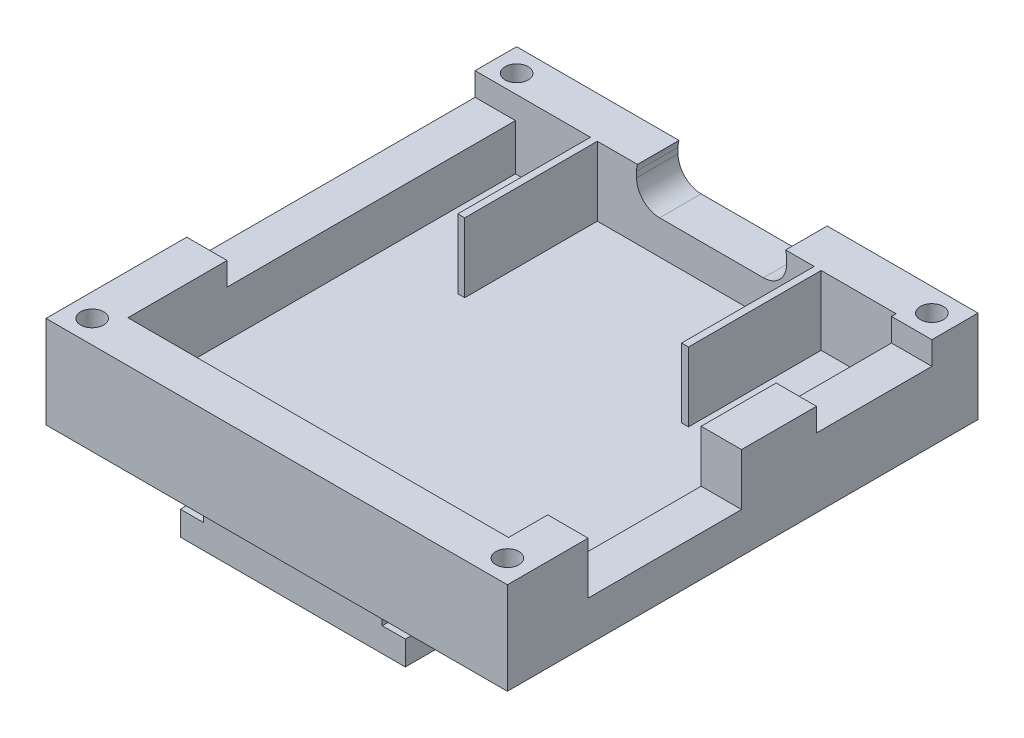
SolidWorks part; units mm, degrees
ref_plane "Alzado" through (0, 0, 0) normal (0, 0, 1) x (1, 0, 0)
ref_plane "Planta" through (0, 0, 0) normal (0, 1, 0) x (1, 0, 0)
ref_plane "Vista lateral" through (0, 0, 0) normal (1, 0, 0) x (0, 0, -1)
sketch "Sketch1" plane through (0, 0, 0) normal (0, 0, 1) x (1, 0, 0)
  line L0 (7.75, 2.1) -> (9.75, 2.1)
  line L1 (-9.75, 2.1) -> (-7.75, 2.1)
  line L2 (-9.75, 2.1) -> (-9.75, 0)
  line L3 (-9.75, 0) -> (9.75, 0)
  line L4 (9.75, 2.1) -> (9.75, 0)
  line L5 (-9.75, 2.1) -> (9.75, 0) construction
  line L6 (-9.75, 0) -> (9.75, 2.1) construction
  line L8 (-7.75, 4) -> (-7.75, 2.1)
  line L10 (7.75, 4) -> (7.75, 2.1)
  line L11 (-7.75, 4) -> (7.75, 2.1) construction
  line L12 (-7.75, 2.1) -> (7.75, 4) construction
  line L13 (7.75, 4) -> (20, 4)
  line L14 (-20, 12) -> (20, 12)
  line L15 (-20, 12) -> (-20, 4)
  line L16 (-20, 4) -> (-7.75, 4)
  line L17 (20, 12) -> (20, 4)
  line L18 (-20, 12) -> (20, 4) construction
  line L19 (-20, 4) -> (20, 12) construction
  point P0 (0, 1.05)
  point P7 (0, 3.05)
  point P12 (0, 8)
extrude "Boss-Extrude1" add sketch "Sketch1" along normal blind 38
sketch "Sketch2" plane through (0, 0, 38) normal (0, 0, 1) x (1, 0, 0)
  line L1 (-20, 4) -> (20, 4)
  line L2 (-20, 4) -> (-20, 12)
  line L3 (-20, 12) -> (20, 12)
  line L4 (20, 4) -> (20, 12)
  line L5 (-20, 4) -> (20, 12) construction
  line L6 (-20, 12) -> (20, 4) construction
  point P0 (0, 8)
extrude "Boss-Extrude2" add sketch "Sketch2" along normal blind 1.4
sketch "Sketch3" plane through (0, 0, 0) normal (0, 0, -1) x (-1, 0, 0)
  line L0 (20, 4) -> (7.75, 4) construction
  line L1 (-20, 4) -> (20, 4)
  line L2 (-20, 4) -> (-20, 12)
  line L3 (-20, 12) -> (20, 12)
  line L4 (20, 4) -> (20, 12)
  line L5 (-20, 4) -> (20, 12) construction
  line L6 (-20, 12) -> (20, 4) construction
  point P0 (0, 8)
extrude "Boss-Extrude3" add sketch "Sketch3" along normal blind 1.4
sketch "Sketch4" plane through (0, 12, 0) normal (0, 1, 0) x (1, 0, 0)
  line L0 (20, -39.4) -> (20, 1.4) construction
  line L1 (-16.5, -35.8) -> (16.5, -35.8)
  line L2 (-16.5, -35.8) -> (-16.5, -2.2)
  line L3 (-16.5, -2.2) -> (16.5, -2.2)
  line L4 (16.5, -35.8) -> (16.5, -2.2)
  line L5 (-16.5, -35.8) -> (16.5, -2.2) construction
  line L6 (-16.5, -2.2) -> (16.5, -35.8) construction
  point P0 (0, -19)
  point P11 (20, -19)
extrude "Cut-Extrude1" cut sketch "Sketch4" against normal blind 6
sketch "Sketch7" plane through (-20, 0, 0) normal (-1, 0, 0) x (0, 0, 1)
  line L0 (39.4, 12) -> (-1.4, 12) construction
  line L1 (2.2, 10) -> (27.2, 10)
  line L2 (2.2, 10) -> (2.2, 14)
  line L3 (2.2, 14) -> (27.2, 14)
  line L4 (27.2, 10) -> (27.2, 14)
  line L5 (2.2, 10) -> (27.2, 14) construction
  line L6 (2.2, 14) -> (27.2, 10) construction
  line L7 (-1.4, 4) -> (-1.4, 12) construction
  point P0 (14.7, 12)
  dimension "D1" = 4
  dimension "D2" = 25
  dimension "D3" = 3.6
extrude "Cut-Extrude3" cut sketch "Sketch7" against normal blind 12
sketch "Sketch8" plane through (0, 6, 0) normal (0, 1, 0) x (1, 0, 0)
  line L5 (16.5, -2.2) -> (-20, -2.2) construction
  line L6 (-10, -13.7) -> (-9.4, -13.7)
  line L13 (-10, -13.7) -> (-10, -2.2)
  line L16 (-10, -2.2) -> (-9.4, -2.2)
  line L17 (10, -13.7) -> (10, -2.2)
  line L18 (-10, -13.7) -> (10, -2.2) construction
  line L19 (-10, -2.2) -> (10, -13.7) construction
  line L20 (9.4, -13.7) -> (10, -13.7)
  line L22 (-9.4, -13.7) -> (-9.4, -2.2)
  line L24 (9.4, -13.7) -> (9.4, -2.2)
  line L25 (-9.4, -13.7) -> (9.4, -2.2) construction
  line L26 (-9.4, -2.2) -> (9.4, -13.7) construction
  line L27 (9.4, -2.2) -> (10, -2.2)
  point P0 (0, -7.95)
  point P7 (0, -7.95)
  dimension "D1" = 20
  dimension "D2" = 11.5
  dimension "D3" = 0.6
sketch "Sketch9" plane through (20, 0, 0) normal (1, 0, 0) x (0, 0, -1)
  line L0 (-39.4, 12) -> (1.4, 12) construction
  line L1 (-12.6, 14) -> (-2.6, 14)
  line L2 (-12.6, 14) -> (-12.6, 10)
  line L3 (-12.6, 10) -> (-2.6, 10)
  line L4 (-2.6, 14) -> (-2.6, 10)
  line L5 (-12.6, 14) -> (-2.6, 10) construction
  line L6 (-12.6, 10) -> (-2.6, 14) construction
  line L7 (1.4, 12) -> (1.4, 4) construction
  line L9 (-32.4, 7.5) -> (-19.1, 7.5)
  line L10 (-32.4, 7.5) -> (-32.4, 16.5)
  line L11 (-32.4, 16.5) -> (-19.1, 16.5)
  line L12 (-19.1, 7.5) -> (-19.1, 16.5)
  line L13 (-32.4, 7.5) -> (-19.1, 16.5) construction
  line L14 (-32.4, 16.5) -> (-19.1, 7.5) construction
  point P0 (-7.6, 12)
  point P9 (-25.75, 12)
  dimension "D1" = 4
  dimension "D2" = 10
  dimension "D3" = 4
  dimension "D4" = 9
  dimension "D5" = 13.3
  dimension "D6" = 6.5
extrude "Cut-Extrude4" cut sketch "Sketch9" against normal blind 7
sketch "Sketch10" plane through (0, 0, -1.4) normal (0, 0, -1) x (-1, 0, 0)
  line L0 (20, 12) -> (-20, 12) construction
  line L1 (-5, 13.45) -> (4, 13.45)
  line L2 (-7, 11.45) -> (-7, 10.95)
  line L3 (-5, 8.95) -> (4, 8.95)
  line L4 (6, 11.45) -> (6, 10.95)
  line L5 (-7, 13.45) -> (6, 8.95) construction
  line L6 (-7, 8.95) -> (6, 13.45) construction
  line L7 (20, 4) -> (20, 12) construction
  arc A0 (-7, 10.95) -> (-5, 8.95) centre (-5, 10.95) ccw
  arc A1 (6, 10.95) -> (4, 8.95) centre (4, 10.95) cw
  arc A2 (6, 11.45) -> (4, 13.45) centre (4, 11.45) ccw
  arc A3 (-5, 13.45) -> (-7, 11.45) centre (-5, 11.45) ccw
  point P0 (-0.5, 11.2)
  dimension "D5" = 2
  dimension "D1" = 4.5
  dimension "D2" = 13
  dimension "D3" = 0.8
  dimension "D4" = 14
extrude "Cut-Extrude5" cut sketch "Sketch10" against normal blind 7
sketch "Sketch11" plane through (0, 12, 0) normal (0, 1, 0) x (1, 0, 0)
  line L0 (-20, -39.4) -> (-20, -27.2) construction
  line L1 (20, -39.4) -> (-20, -39.4) construction
  line L2 (20, -39.4) -> (20, -32.4) construction
  line L3 (-20, 1.4) -> (-5.9229, 1.4) construction
  circle A0 centre (-18, -37.4) radius 1
  circle A1 centre (18, -37.4) radius 1
  circle A2 centre (-18, -0.6) radius 1
  circle A3 centre (18, -0.6) radius 1
  dimension "D1" = 2
  dimension "D2" = 2
  dimension "D3" = 2
  dimension "D5" = 2
  dimension "D7" = 2
  dimension "D4" = 2
  dimension "D6" = 2
extrude "Cut-Extrude6" cut sketch "Sketch11" against normal blind 4
extrude "Boss-Extrude4" add sketch "Sketch8" along normal blind 6
equation "\"alto\"= 8"
equation "\"D6@Sketch1\"=\"alto\""
equation "\"ancho\"= 40"
equation "\"D5@Sketch1\"=\"ancho\""
equation "\"placa_ancho\"= 33"
equation "\"D2@Sketch4\"=\"placa_ancho\""
equation "\"placa_largo\"= 33.6"
equation "\"D1@Sketch4\"=\"placa_largo\""
equation "\"D1@Cut-Extrude1\"=\"alto\"-2"
equation "\"largo\"= 2.8"
equation "\"D1@Boss-Extrude2\"=\"largo\"/2"
equation "\"D1@Boss-Extrude3\"=\"largo\"/2"
